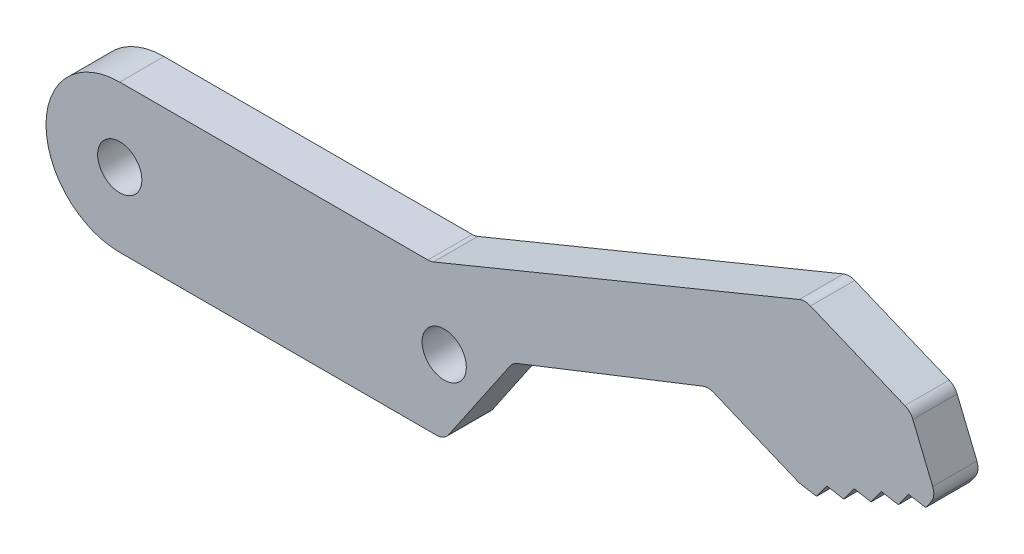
SolidWorks part; units mm, degrees
ref_plane "Front Plane" through (0, 0, 0) normal (0, 0, 1) x (1, 0, 0)
ref_plane "Top Plane" through (0, 0, 0) normal (0, 1, 0) x (1, 0, 0)
ref_plane "Right Plane" through (0, 0, 0) normal (1, 0, 0) x (0, 0, -1)
sketch "Sketch1" plane through (0, 0, 0) normal (0, 0, 1) x (1, 0, 0)
  line L0 (0, 0) -> (22, 0) construction
  line L1 (0, 5) -> (22, 5)
  line L2 (0, -5) -> (22, -5)
  line L3 (20.0937, 4.5893) -> (23.918, -4.6175) construction
  line L4 (23.918, -4.6175) -> (46.0818, 4.4952) construction
  line L5 (55.3306, 8.2978) -> (51.5396, 17.5183) construction
  line L6 (51.5396, 17.5183) -> (20.0937, 4.5893) construction
  line L7 (20.0937, 4.5893) -> (46.4528, 15.4268)
  line L8 (46.4528, 15.4268) -> (53.6194, 12.4597)
  line L9 (53.6194, 12.4597) -> (55.3306, 8.2978)
  line L10 (55.3306, 8.2978) -> (47.9316, 5.2557)
  line L11 (46.0818, 4.4952) -> (39.9, 7.0545)
  line L12 (39.9, 7.0545) -> (26.6518, 1.8333)
  line L13 (46.0818, 4.4952) -> (47.2444, 4.2974)
  line L14 (47.2444, 4.2974) -> (47.9316, 5.2557)
  line L15 (47.2444, 4.2974) -> (54.6434, 7.3395) construction
  line L16 (47.9316, 5.2557) -> (49.0941, 5.0579)
  line L17 (49.0941, 5.0579) -> (49.7813, 6.0162)
  line L18 (49.7813, 6.0162) -> (50.9439, 5.8184)
  line L19 (50.9439, 5.8184) -> (51.6311, 6.7767)
  line L20 (51.6311, 6.7767) -> (52.7936, 6.5789)
  line L21 (52.7936, 6.5789) -> (53.4808, 7.5373)
  line L22 (53.4808, 7.5373) -> (54.6434, 7.3395)
  line L23 (54.6434, 7.3395) -> (55.3306, 8.2978)
  line L24 (47.9316, 5.2557) -> (55.3306, 8.2978) construction
  line L25 (26.6518, 1.8333) -> (22, -5)
  arc A0 (0, 5) -> (0, -5) centre (0, 0) ccw
  arc A1 (22, -5) -> (22, 5) centre (22, 0) ccw
  circle A2 centre (0, 0) radius 1.5
  circle A3 centre (22, 0) radius 1.5
  point P2 (11, 0)
  dimension "D11" = 3
  dimension "D1" = 22
  dimension "D2" = 10
  dimension "D3" = 157.65
  dimension "D4" = 1.95
  dimension "D5" = 34
  dimension "D6" = 14.24
  dimension "D7" = 10
  dimension "D8" = 4.5
  dimension "D9" = 5.5
  dimension "D10" = 136
  dimension "D12" = 0.625
  dimension "D13" = 2
  dimension "D14" = 8
  dimension "D15" = 2
  dimension "D16" = 2
extrude "Boss-Extrude1" add sketch "Sketch1" along normal blind 3
fillet "Fillet1" radius 1 8 edges at (39.9, 7.0545, 1.5) (21.0925, 5, 1.5) (46.0818, 4.4952, 1.5) (55.3306, 8.2978, 1.5) (22, -5, 1.5) (53.6194, 12.4597, 1.5) (46.4528, 15.4268, 1.5) (26.6518, 1.8333, 1.5)
